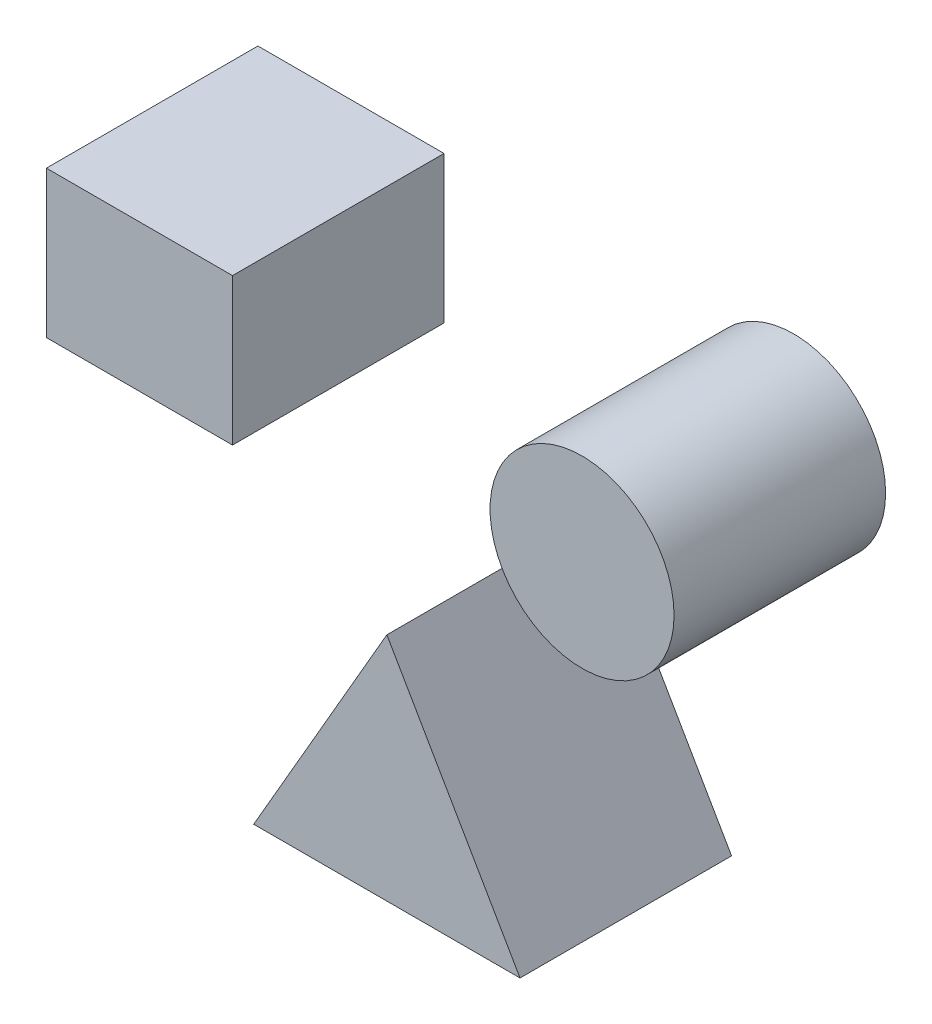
SolidWorks part; units mm, degrees
ref_plane "Front Plane" through (0, 0, 0) normal (0, 0, 1) x (1, 0, 0)
ref_plane "Top Plane" through (0, 0, 0) normal (0, 1, 0) x (1, 0, 0)
ref_plane "Right Plane" through (0, 0, 0) normal (1, 0, 0) x (0, 0, -1)
sketch "Sketch1" plane through (0, 0, 0) normal (0, 0, 1) x (1, 0, 0)
  line L0 (-14.2264, -39.3679) -> (7.3585, -1.9818)
  line L1 (-47.8301, 35.9339) -> (-17.6604, 35.9339)
  line L2 (-47.8301, 35.9339) -> (-47.8301, 12.1415)
  line L3 (-47.8301, 12.1415) -> (-17.6604, 12.1415)
  line L4 (-17.6604, 35.9339) -> (-17.6604, 12.1415)
  line L5 (7.3585, -1.9818) -> (28.9434, -39.3679)
  line L6 (28.9434, -39.3679) -> (-14.2264, -39.3679)
  circle A0 centre (38.9999, 24.0377) radius 14.9124
extrude "Extrude1" add sketch "Sketch1" along normal blind 34.29
